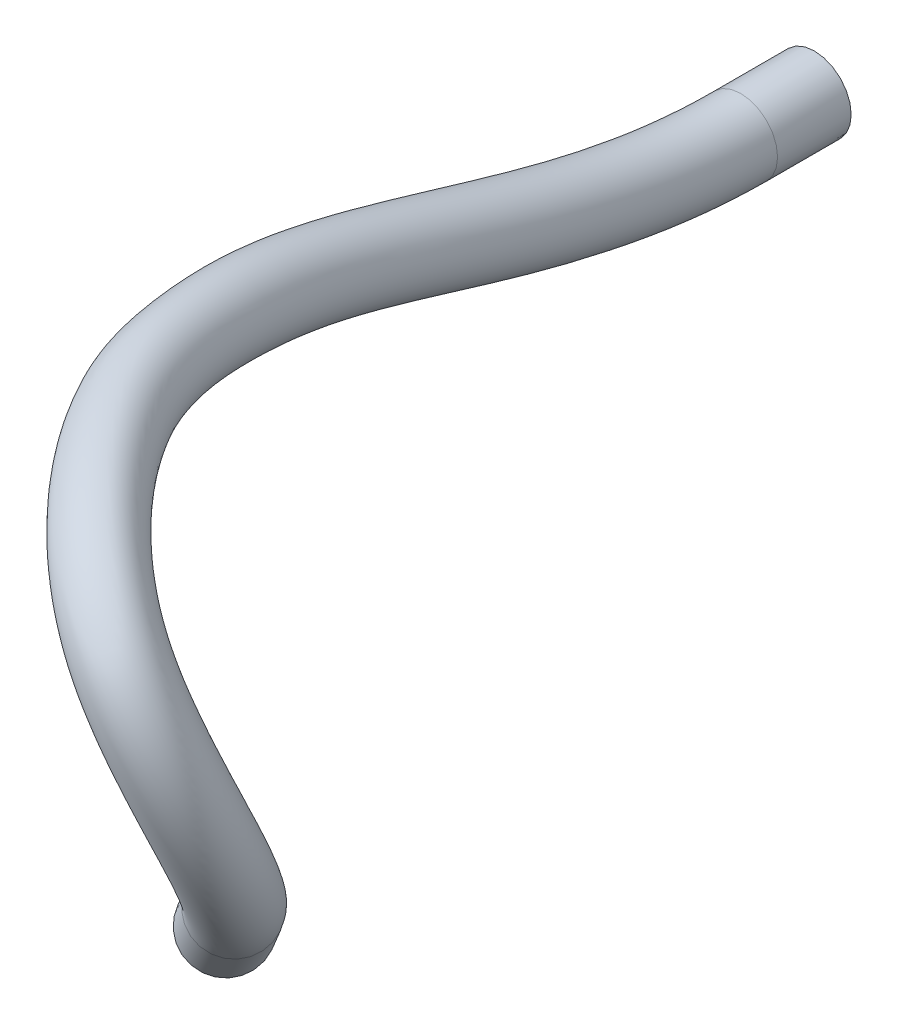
SolidWorks part; units mm, degrees
ref_plane "Front" through (0, 0, 0) normal (0, 0, 1) x (1, 0, 0)
ref_plane "Top" through (0, 0, 0) normal (0, 1, 0) x (1, 0, 0)
ref_plane "Right" through (0, 0, 0) normal (1, 0, 0) x (0, 0, -1)
sketch3d "3DSketch1"
  line L0 (0, 13.5636, 12.7) -> (0, 13.5636, 0)
  line L1 (32.1731, -32.3752, 132.1981) -> (39.1579, -23.3135, 137.7107)
  circle A0 centre (0, 13.5636, 0) radius 6.35 construction
  circle A1 centre (32.1731, -32.3752, 132.1981) radius 5.9055 construction
  spline_without_curve S0
  point P10 (0, 13.5636, 6.35)
  point P14 (28.9252, -36.5889, 129.6348)
  dimension "D1" = 12.7
  dimension "D2" = 12.7
sketch "Sketch2" plane through (0, 0, 0) normal (0, 0, 1) x (1, 0, 0)
  circle A0 centre (0, 13.5636) radius 6.35 construction
  circle A1 centre (0, 13.5636) radius 6.35
sweep "Base-Sweep" add profiles "Sketch2" path "3DSketch1"
